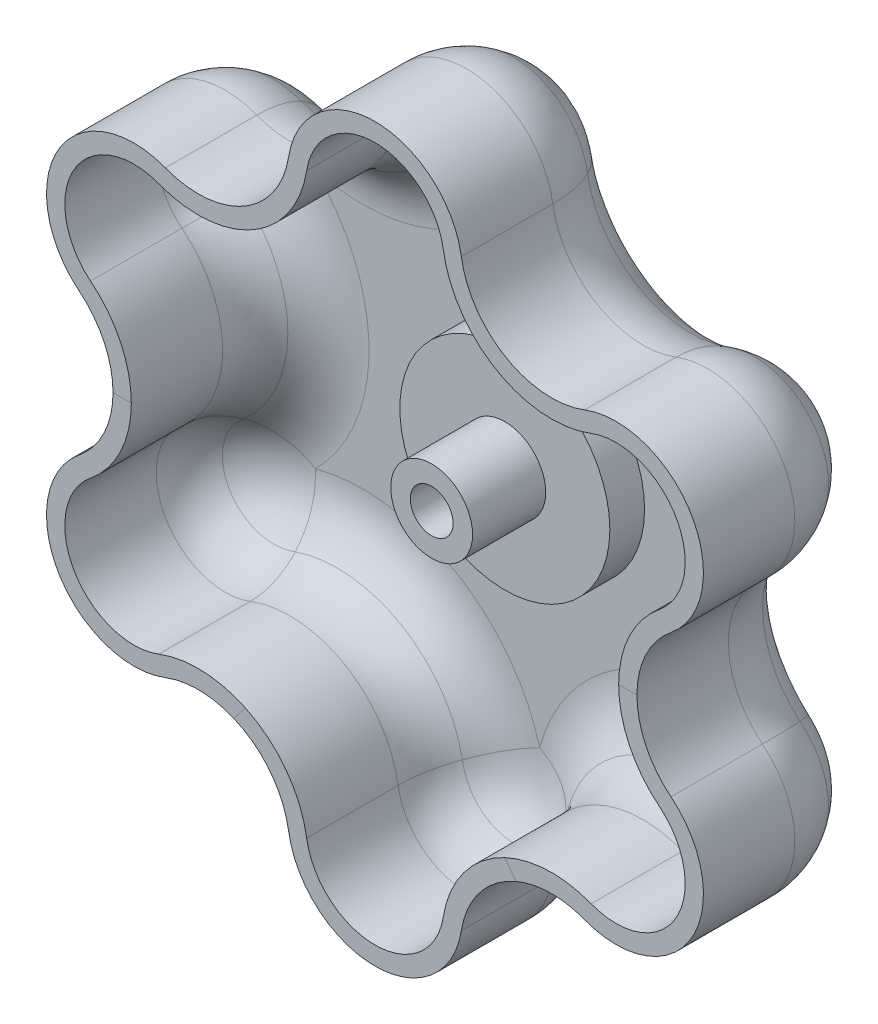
SolidWorks part; units mm, degrees
ref_plane "Plane1" through (0, 0, 0) normal (0, 0, 1) x (1, 0, 0)
ref_plane "Plane2" through (0, 0, 0) normal (0, 1, 0) x (1, 0, 0)
ref_plane "Plane3" through (0, 0, 0) normal (1, 0, 0) x (0, 0, -1)
imported_body "Imported1"
sketch "Sketch1" plane through (0, 0, 12.7) normal (0, 0, 1) x (1, 0, 0)
  line L0 (-27.94, 0) -> (27.94, 0)
  line L1 (27.94, 0) -> (33.02, -11.43)
  line L2 (33.02, -11.43) -> (16.51, -24.13)
  line L3 (16.51, -24.13) -> (5.8627, -10.2886)
  line L4 (0, 10.16) -> (0, -27.94) construction
  line L5 (-27.94, 0) -> (-33.02, -11.43)
  line L6 (-33.02, -11.43) -> (-16.51, -24.13)
  line L7 (-16.51, -24.13) -> (-5.8627, -10.2886)
  line L8 (-5.8627, -10.2886) -> (5.8627, -10.2886)
  arc A0 (15.5704, -8.9896) -> (0, -17.9792) centre (12.2707, -21.2534) ccw construction
  point P12 (0, 0)
sketch "Sketch2" plane through (0, 0, 0) normal (0, 0, -1) x (-1, 0, 0)
  circle A0 centre (0, 0) radius 10.16
  dimension "D1" = 20.32
sketch "Sketch3" plane through (0, 0, 4.445) normal (0, 0, 1) x (1, 0, 0)
  line L1 (-10.9645, 8.6208) -> (13.3621, 8.6208)
  line L2 (-10.9645, 8.6208) -> (-10.9645, -8.6004)
  line L3 (-10.9645, -8.6004) -> (13.3621, -8.6004)
  line L4 (13.3621, 8.6208) -> (13.3621, -8.6004)
  arc A0 (-15.5704, 8.9896) -> (0, 17.9792) centre (-12.2707, 21.2534) ccw construction
  arc A1 (15.5704, -8.9896) -> (0, -17.9792) centre (12.2707, -21.2534) ccw construction
extrude "Cut-Extrude1" cut sketch "Sketch3" against normal blind 0.762
sketch "Sketch4" plane through (0, 0, 3.683) normal (0, 0, 1) x (1, 0, 0)
  circle A0 centre (0, 0) radius 1.4863
  circle A1 centre (0, 0) radius 2.8398
extrude "Boss-Extrude1" add sketch "Sketch4" along normal blind 5.08
